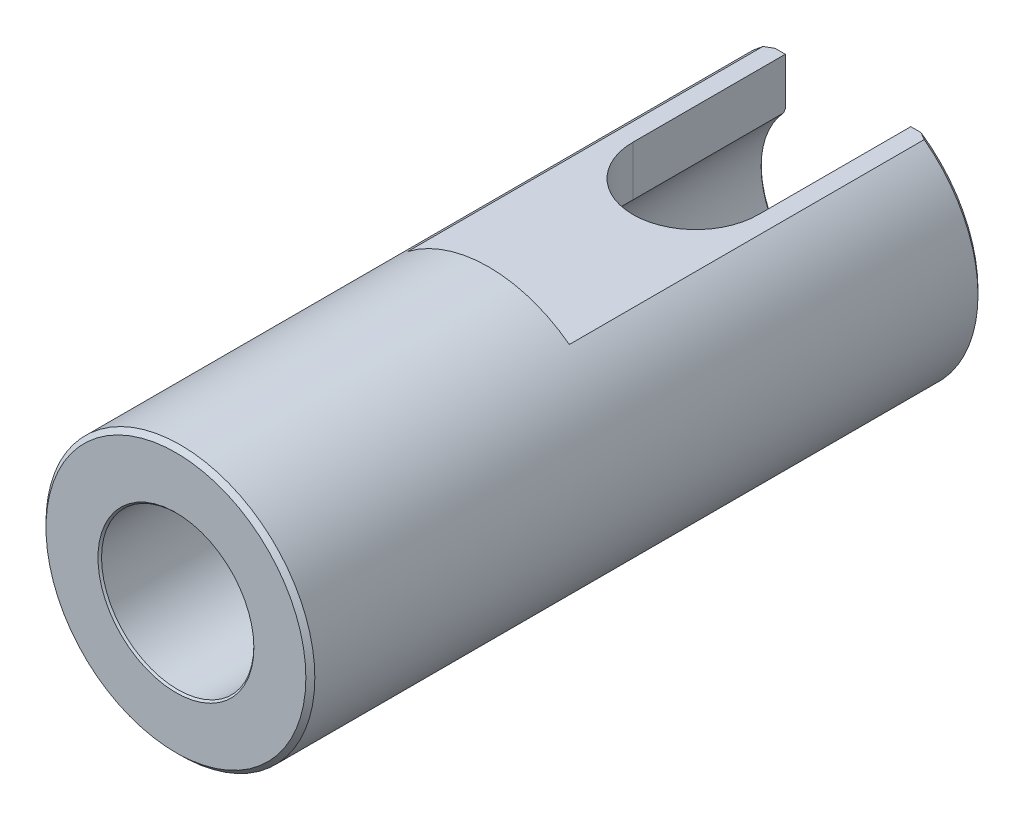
SolidWorks part; units mm, degrees
ref_plane "Front" through (0, 0, 0) normal (0, 0, 1) x (1, 0, 0)
ref_plane "Top" through (0, 0, 0) normal (0, 1, 0) x (1, 0, 0)
ref_plane "Right" through (0, 0, 0) normal (1, 0, 0) x (0, 0, -1)
sketch "Esquisse1" plane through (0, 0, 0) normal (1, 0, 0) x (0, 0, -1)
  line L0 (0, 0) -> (-31.822, 0) construction
  line L1 (-29.822, 8.5) -> (-29.822, 15)
  line L2 (-29.822, 15) -> (45.178, 15)
  line L3 (45.178, 15) -> (45.178, 9.5)
  line L4 (0, 0) -> (-31.822, 0) construction
  line L5 (-29.822, 8.5) -> (20.178, 8.5)
  line L6 (20.178, 8.5) -> (20.178, 9.5)
  line L7 (20.178, 9.5) -> (45.178, 9.5)
  dimension "D1" = 17
  dimension "D2" = 19
  dimension "D3" = 30
  dimension "D4" = 75
  dimension "D5" = 50
revolve "Révolution1" add sketch "Esquisse1" angle 360 about L0
chamfer "Chanfrein1" distance 0.5 angle 45 2 edges at (-15, 0, -45.178) (-15, 0, 29.822)
chamfer "Chanfrein2" distance 0.2 angle 45 2 edges at (-8.5, 0, 29.822) (-9.5, 0, -45.178)
sketch "Esquisse2" plane through (0, 0, -45.178) normal (0, 0, 1) x (1, 0, 0)
  line L0 (-15, 0) -> (15, 0) construction
  line L6 (-16.0903, 24.226) -> (16.265, 24.226)
  line L7 (-16.0903, 24.226) -> (-16.0903, 12)
  line L8 (-16.0903, 12) -> (16.265, 12)
  line L9 (16.265, 24.226) -> (16.265, 12)
  line L10 (-16.0903, -12) -> (16.265, -12)
  line L11 (-16.0903, -12) -> (-16.0903, -23.8387)
  line L12 (-16.0903, -23.8387) -> (16.265, -23.8387)
  line L13 (16.265, -12) -> (16.265, -23.8387)
  circle A1 centre (0, 0) radius 15 construction
  dimension "D1" = 12
  dimension "D2" = 12
extrude "Enlèv. mat.-Extru.1" cut sketch "Esquisse2" along normal blind 40.1
sketch "Esquisse3" plane through (0, 12, 0) normal (0, 1, 0) x (1, 0, 0)
  line L0 (0, 45.178) -> (0, -29.822) construction
  line L1 (-8.1394, 45.178) -> (8.1394, 45.178) construction
  line L2 (-9, -29.822) -> (9, -29.822) construction
  line L3 (7, 28.178) -> (7, 45.178)
  line L4 (7, 45.178) -> (-7, 45.178)
  line L5 (-7, 45.178) -> (-7, 28.178)
  arc A0 (-7, 28.178) -> (7, 28.178) centre (0, 28.178) ccw
  dimension "D1" = 14
  dimension "D2" = 17
extrude "Enlèv. mat.-Extru.2" cut sketch "Esquisse3" against normal up to next
hole_wizard "Trou taraudé M41" positions "Esquisse5" profile "Esquisse6" tap size "M4" standard "ISO"
sketch "Esquisse5" plane through (0, -12, 0) normal (0, -1, 0) x (-1, 0, 0)
  line L1 (-8.1394, 45.178) -> (-14.5, 45.178) construction
  point P0 (0, 15.178)
  dimension "D1" = 30
sketch "Esquisse6" plane through (0, -12, -15.178) normal (1, 0, 0) x (0, 0, -1)
  line L0 (0, 0) -> (0, 3.5)
  line L1 (0, 3.5) -> (1.65, 3.5)
  line L2 (1.65, 3.5) -> (1.65, 0)
  line L5 (1.65, 0) -> (0, 0)
  line L11 (0, -6.35) -> (0, 107.95) construction
  dimension "Diamètre du trou pour taraudage jusqu'au prochain" = 3.3
  dimension "Profondeur du trou pour taraudage jusqu'au prochain" = 3.5
